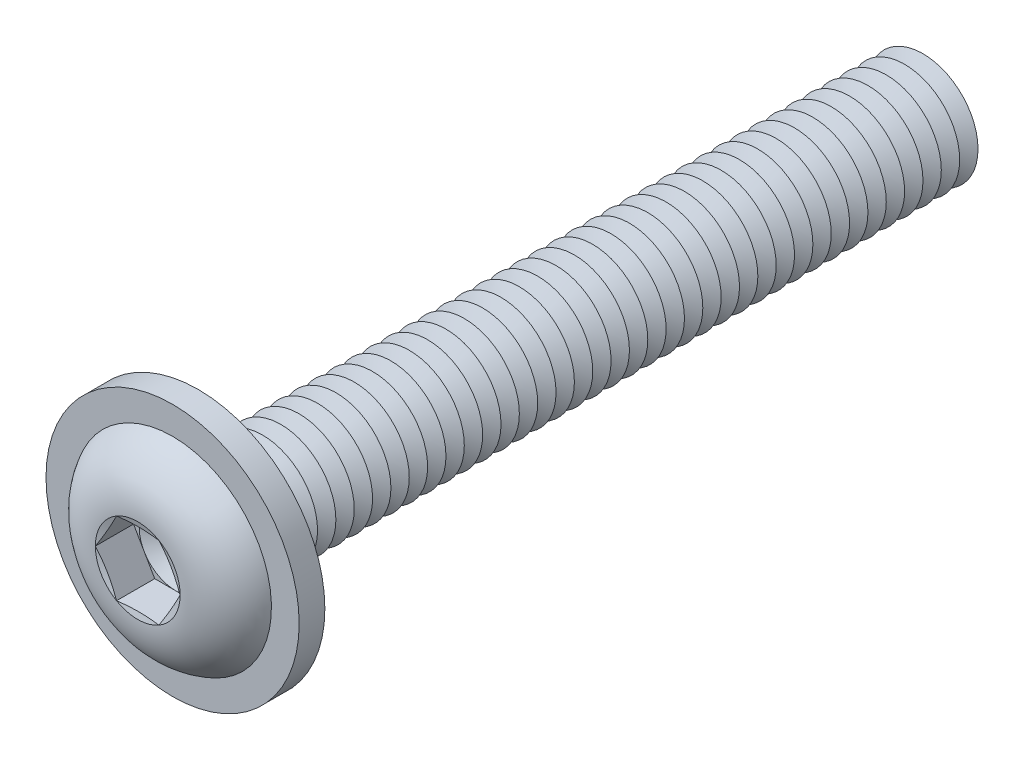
SolidWorks part; units mm, degrees
ref_plane "Front Plane" through (0, 0, 0) normal (0, 0, 1) x (1, 0, 0)
ref_plane "Top Plane" through (0, 0, 0) normal (0, 1, 0) x (1, 0, 0)
ref_plane "Right Plane" through (0, 0, 0) normal (1, 0, 0) x (0, 0, -1)
sketch "Sketch1" plane through (0, 0, 0) normal (1, 0, 0) x (0, 0, -1)
  line L0 (0, 1.5) -> (0, 2.85)
  line L3 (0, 1.5) -> (20, 1.5)
  line L4 (20, 1.5) -> (20, 0)
  line L5 (20, 0) -> (-1.65, 0) construction
  line L6 (-1.65, 0) -> (20, 0)
  line L7 (-1.65, 1.1547) -> (-1.65, 0.5773) construction
  line L8 (-1.65, 0.5773) -> (-1.65, 0)
  line L9 (-1.65, 1.1547) -> (-1.4953, 0.5773)
  line L10 (-1.4953, 0.5773) -> (-1.65, 0.5773)
  line L11 (20, 0) -> (22.7481, 0) construction
  line L12 (0, 2.85) -> (-1.65, 2.85) construction
  arc A1 (0, 2.85) -> (-1.65, 1.1547) centre (0, 1.1994) ccw
  point P8 (20, 0.75)
  dimension "D1" = 5.7
  dimension "D2" = 3
  dimension "D3" = 1.65
  dimension "D4" = 2.3094
  dimension "D5" = 20
  dimension "D6" = 15
revolve "Revolve1" add sketch "Sketch1" angle 360 about L5
fillet "Fillet1" radius 0.25 1 edges at (-1.5, 0, 0)
sketch "Sketch2" plane through (0, 0, 0) normal (1, 0, 0) x (0, 0, -1)
  line L0 (19.75, 1.5) -> (20.25, 1.5)
  line L1 (20, 1.5) -> (0.25, 1.5) construction
  line L2 (20.25, 1.5) -> (20, 1.067)
  line L3 (20, -1.5) -> (20, 1.5) construction
  line L4 (20, 1.067) -> (19.75, 1.5)
  dimension "D1" = 0.5
revolve "Cut-Revolve1" cut sketch "Sketch2" angle 360 about axis through (0, 0, -20) along (0, 0, -1)
pattern_linear "LPattern1" count 40 spacing 0.5 along (0, 0, 1) of "Cut-Revolve1"
sketch "Sketch3" plane through (0, 0, 1.65) normal (0, 0, 1) x (1, 0, 0)
  line L7 (0.5773, 1) -> (-0.5774, 1)
  line L8 (-0.5774, 1) -> (-1.1547, 0)
  line L9 (-1.1547, 0) -> (-0.5773, -1)
  line L10 (-0.5773, -1) -> (0.5773, -1)
  line L11 (0.5773, -1) -> (1.1547, 0)
  line L12 (1.1547, 0) -> (0.5773, 1)
  circle A0 centre (0, 0) radius 1 construction
  circle A3 centre (0, 0) radius 1.1547 construction
extrude "Cut-Extrude1" cut sketch "Sketch3" against normal blind 1.04
sketch "Sketch4" plane through (0, 0, 0.61) normal (0, 0, 1) x (1, 0, 0)
  line L1 (0.5773, 1) -> (-0.5774, 1) construction
  circle A0 centre (0, 0) radius 1
extrude "Cut-Extrude2" cut sketch "Sketch4" against normal through all draft 60
sketch "Sketch5" plane through (0, 0, 0) normal (0, 0, -1) x (-1, 0, 0)
  circle A0 centre (0, 0) radius 3.45
  circle A1 centre (0, 0) radius 1.75
  circle A2 centre (0, 0) radius 1.75 construction
  dimension "D1" = 6.9
extrude "Boss-Extrude1" add sketch "Sketch5" against normal blind 0.7
